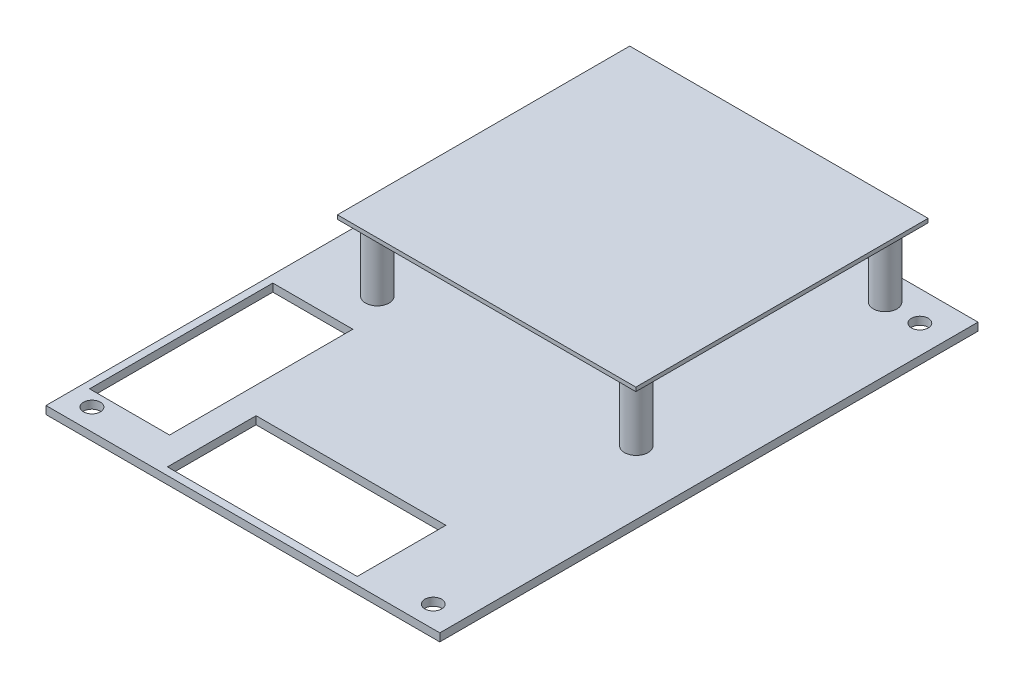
SolidWorks part; units mm, degrees
ref_plane "Front Plane" through (0, 0, 0) normal (0, 0, 1) x (1, 0, 0)
ref_plane "Top Plane" through (0, 0, 0) normal (0, 1, 0) x (1, 0, 0)
ref_plane "Right Plane" through (0, 0, 0) normal (1, 0, 0) x (0, 0, -1)
sketch "Sketch1" plane through (0, 0, 0) normal (0, 1, 0) x (1, 0, 0)
  line L1 (-38.1, 52.07) -> (38.1, 52.07)
  line L2 (-38.1, 52.07) -> (-38.1, -52.07)
  line L3 (-38.1, -52.07) -> (38.1, -52.07)
  line L4 (38.1, 52.07) -> (38.1, -52.07)
  line L5 (-38.1, 52.07) -> (38.1, -52.07) construction
  line L6 (-38.1, -52.07) -> (38.1, 52.07) construction
  point P0 (0, 0)
  dimension "D1" = 76.2
  dimension "D2" = 104.14
extrude "Boss-Extrude1" add sketch "Sketch1" along normal blind 1.524
hole_wizard "#4 Clearance Hole1" positions "Sketch3" profile "Sketch2" hole size "#4" standard "ANSI Inch"
sketch "Sketch3" plane through (0, 1.524, 0) normal (0, 1, 0) x (1, 0, 0)
  line L0 (-38.1, -52.07) -> (38.1, -52.07) construction
  line L1 (-38.1, 52.07) -> (-38.1, -52.07) construction
  point P0 (-33.401, 46.2788)
  point P2 (32.639, 46.2788)
  point P4 (-33.401, -47.879)
  point P6 (32.639, -47.879)
  dimension "D1" = 4.191
  dimension "D2" = 4.699
  dimension "D3" = 70.739
  dimension "D4" = 4.191
  dimension "D5" = 4.699
  dimension "D6" = 98.3488
sketch "Sketch2" plane through (-33.401, 1.524, -46.2788) normal (1, 0, 0) x (0, 0, 1)
  line L0 (0, 0) -> (0, 1.524)
  line L1 (0, 1.524) -> (1.6319, 1.524)
  line L2 (1.6319, 1.524) -> (1.6319, 0)
  line L5 (1.6319, 0) -> (0, 0)
  line L11 (0, -6.35) -> (0, 107.95) construction
  dimension "Thru Hole Dia." = 3.2639
  dimension "Thru Hole Depth" = 1.524
sketch "Sketch4" plane through (0, 1.524, 0) normal (0, 1, 0) x (1, 0, 0)
  circle A0 centre (-24.3463, 46.441) radius 2.286
  circle A1 centre (25.7646, 46.441) radius 2.286
  circle A2 centre (-24.3463, -1.7137) radius 2.286
  circle A3 centre (25.7646, -1.7137) radius 2.286
  dimension "D1" = 4.572
extrude "Boss-Extrude2" add sketch "Sketch4" along normal blind 12.7
sketch "Sketch5" plane through (0, 14.224, 0) normal (0, 1, 0) x (1, 0, 0)
  line L1 (-28.397, -5.3836) -> (29.3436, -5.3836)
  line L2 (-28.397, -5.3836) -> (-28.397, 51.1738)
  line L3 (-28.397, 51.1738) -> (29.3436, 51.1738)
  line L4 (29.3436, -5.3836) -> (29.3436, 51.1738)
extrude "Boss-Extrude3" add sketch "Sketch5" along normal blind 0.762
sketch "Sketch7" plane through (0, 0, 0) normal (0, -1, 0) x (1, 0, 0)
  line L1 (-36.6752, 45.0663) -> (-21.1962, 45.0663)
  line L2 (-36.6752, 45.0663) -> (-36.6752, 9.6068)
  line L3 (-36.6752, 9.6068) -> (-21.1962, 9.6068)
  line L4 (-21.1962, 45.0663) -> (-21.1962, 9.6068)
  line L5 (-16.0629, 50.6113) -> (20.6602, 50.6113)
  line L6 (-16.0629, 50.6113) -> (-16.0629, 33.4571)
  line L7 (-16.0629, 33.4571) -> (20.6602, 33.4571)
  line L8 (20.6602, 50.6113) -> (20.6602, 33.4571)
extrude "Cut-Extrude1" cut sketch "Sketch7" against normal through all
